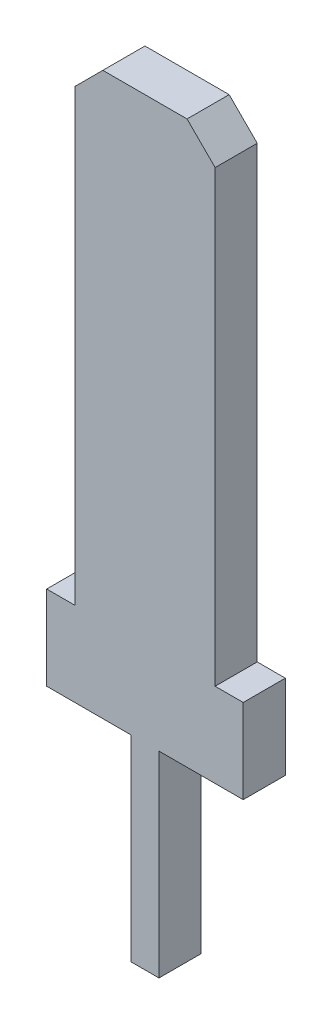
SolidWorks part; units mm, degrees
ref_plane "Plan de face" through (0, 0, 0) normal (0, 0, 1) x (1, 0, 0)
ref_plane "Plan de dessus" through (0, 0, 0) normal (0, 1, 0) x (1, 0, 0)
ref_plane "Plan de droite" through (0, 0, 0) normal (1, 0, 0) x (0, 0, -1)
sketch "Esquisse1" plane through (0, 0, 0) normal (0, 0, 1) x (1, 0, 0)
  line L0 (0, 68.6352) -> (0, -75.9239) construction
  line L1 (1.25, 10) -> (-1.25, 10)
  line L2 (-1.25, 10) -> (-1.25, 1.5)
  line L3 (-1.75, 1.5) -> (-1.25, 1.5)
  line L4 (-1.75, 1.5) -> (-1.75, 0)
  line L5 (-1.75, 0) -> (-0.25, 0)
  line L6 (-0.25, 0) -> (-0.25, -3.5)
  line L7 (-0.25, -3.5) -> (0.25, -3.5)
  line L8 (1.25, 10) -> (1.25, 1.5)
  line L9 (1.75, 1.5) -> (1.25, 1.5)
  line L10 (1.75, 1.5) -> (1.75, 0)
  line L11 (1.75, 0) -> (0.25, 0)
  line L12 (0.25, 0) -> (0.25, -3.5)
  point P12 (0, 10)
  point P17 (0, -3.5)
  dimension "D1" = 1.5
  dimension "D2" = 8.5
  dimension "D3" = 3.5
  dimension "D4" = 1.25
  dimension "D5" = 1.75
  dimension "D6" = 0.25
extrude "Extrusion1" add sketch "Esquisse1" along normal mid plane 0.75
chamfer "Chanfrein1" distance 0.5 angle 45 1 edges at (1.25, 10, 0)
chamfer "Chanfrein2" distance 0.5 angle 45 1 edges at (-1.25, 10, 0)
